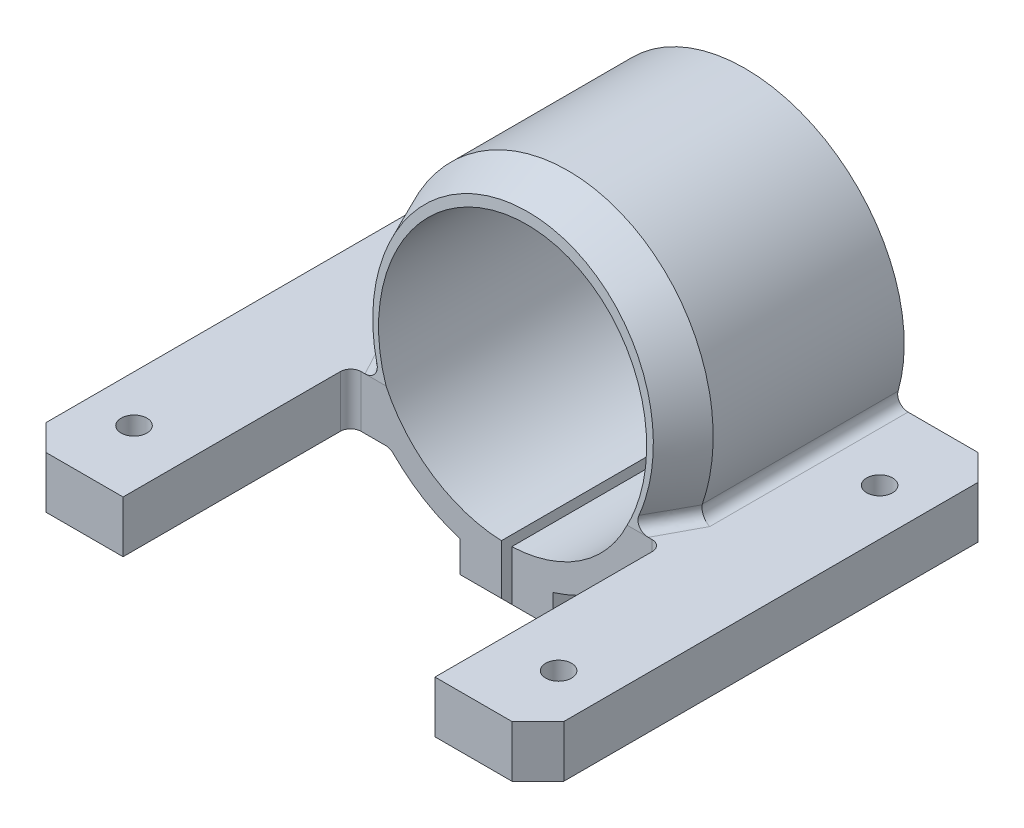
SolidWorks part; units mm, degrees
ref_plane "Plan de face" through (0, 0, 0) normal (0, 0, 1) x (1, 0, 0)
ref_plane "Plan de dessus" through (0, 0, 0) normal (0, 1, 0) x (1, 0, 0)
ref_plane "Plan de droite" through (0, 0, 0) normal (1, 0, 0) x (0, 0, -1)
sketch "Esquisse1" plane through (0, 0, 0) normal (0, 0, 1) x (1, 0, 0)
  line L0 (-22.4625, -21) -> (-50, -21)
  line L1 (-50, -21) -> (-50, -11)
  line L2 (-50, -11) -> (-28.7152, -11)
  line L3 (50, -11) -> (50, -21)
  line L4 (50, -21) -> (22.4625, -21)
  line L5 (50, -11) -> (28.7152, -11)
  circle A0 centre (0, 0) radius 25.75
  arc A1 (-22.4625, -21) -> (22.4625, -21) centre (0, 0) ccw
  arc A2 (-28.7152, -11) -> (28.7152, -11) centre (0, 0) cw
  dimension "D1" = 51.5
  dimension "D2" = 100
  dimension "D4" = 10
  dimension "D5" = 5
  dimension "D3" = 50
  dimension "D6" = 11
extrude "Boss.-Extru.1" add sketch "Esquisse1" along normal blind 90
sketch "Esquisse2" plane through (0, 0, 90) normal (0, 0, 1) x (1, 0, 0)
  line L0 (-9, -24.126) -> (-5.6186, -28.4245)
  line L1 (-5.6186, -28.4245) -> (0, -29.6543)
  line L2 (0, -29.6543) -> (6.455, -28.4245)
  line L3 (6.455, -28.4245) -> (9, -24.126)
  line L4 (9, -24.126) -> (9, -40.395)
  line L5 (9, -40.395) -> (-9, -40.395)
  line L6 (-9, -40.395) -> (-9, -24.126)
  circle A0 centre (0, 0) radius 25.75 construction
  arc A1 (-22.4625, -21) -> (22.4625, -21) centre (0, 0) ccw construction
  point P4 (0, -30.75)
  dimension "D1" = 18
  dimension "D2" = 9
extrude "Boss.-Extru.2" add sketch "Esquisse2" against normal up to surface (90 mm away)
sketch "Esquisse3" plane through (0, 0, 90) normal (0, 0, 1) x (1, 0, 0)
  line L0 (-9, -40.395) -> (9, -40.395) construction
  line L1 (-1, -40.395) -> (1, -40.395)
  line L2 (-1, -40.395) -> (-1, -17.0791)
  line L3 (-1, -17.0791) -> (1, -17.0791)
  line L4 (1, -40.395) -> (1, -17.0791)
  line L5 (-9, -29.4034) -> (-9, -40.395) construction
  line L6 (9, -40.395) -> (9, -29.4034) construction
  dimension "D1" = 8
  dimension "D2" = 8
  dimension "D3" = 2
extrude "Enlèv. mat.-Extru.1" cut sketch "Esquisse3" against normal through all contours L4 L3 L2 L1
sketch "Esquisse4" plane through (9, 0, 0) normal (1, 0, 0) x (0, 0, -1)
  line L0 (-90, -40.395) -> (-90, -29.4034) construction
  line L1 (0, -40.395) -> (-90, -40.395) construction
  circle A0 centre (-35, -35.395) radius 2.5
  circle A1 centre (-10, -35.395) radius 2.5
  dimension "D1" = 55
  dimension "D2" = 25
  dimension "D3" = 5
extrude "Enlèv. mat.-Extru.2" cut sketch "Esquisse4" against normal through all
sketch "Esquisse5" plane through (0, -11, 0) normal (0, 1, 0) x (1, 0, 0)
  line L0 (-50, -90) -> (-50, 0) construction
  line L2 (-28.7152, 0) -> (-50, 0) construction
  circle A0 centre (41, -15) radius 2.5
  circle A1 centre (-41, -15) radius 2.5
  dimension "D1" = 82
  dimension "D2" = 9
  dimension "D4" = 15
extrude "Enlèv. mat.-Extru.3" cut sketch "Esquisse5" against normal through all
sketch "Esquisse8" plane through (0, -21, 0) normal (0, -1, 0) x (1, 0, 0)
  line L1 (-45.2147, 15) -> (-43.1073, 11.35)
  line L2 (-43.1073, 11.35) -> (-38.8927, 11.35)
  line L3 (-38.8927, 11.35) -> (-36.7853, 15)
  line L4 (-36.7853, 15) -> (-38.8927, 18.65)
  line L5 (-38.8927, 18.65) -> (-43.1073, 18.65)
  line L6 (-43.1073, 18.65) -> (-45.2147, 15)
  line L7 (45.2147, 15) -> (43.1073, 18.65)
  line L8 (43.1073, 18.65) -> (38.8927, 18.65)
  line L9 (38.8927, 18.65) -> (36.7853, 15)
  line L10 (36.7853, 15) -> (38.8927, 11.35)
  line L11 (38.8927, 11.35) -> (43.1073, 11.35)
  line L12 (43.1073, 11.35) -> (45.2147, 15)
  circle A0 centre (-41, 15) radius 3.65 construction
  circle A1 centre (41, 15) radius 3.65 construction
  dimension "D1" = 7.3
  dimension "D2" = 7.3
extrude "Enlèv. mat.-Extru.6" cut sketch "Esquisse8" against normal blind 3.5 contours L6 L1 L2 L3 L4 L5
pattern_linear "Répétition linéaire1" count 2 spacing 62 along (0, 0, 1) of "Enlèv. mat.-Extru.3", "Enlèv. mat.-Extru.6"
sketch "Esquisse9" plane through (0, -11, 0) normal (0, 1, 0) x (1, 0, 0)
  line L0 (-28.7152, -90) -> (-50, -90) construction
  line L1 (-30.1117, -90) -> (30.1235, -90)
  line L2 (-30.1117, -90) -> (-30.1117, -46.0412)
  line L3 (-30.1117, -46.0412) -> (30.1235, -46.0412)
  line L4 (30.1235, -90) -> (30.1235, -46.0412)
  line L5 (50, -90) -> (28.7152, -90) construction
extrude "Enlèv. mat.-Extru.7" cut sketch "Esquisse9" against normal through all and the other way through all draft 6
sketch "Esquisse10" plane through (9, 0, 0) normal (1, 0, 0) x (0, 0, -1)
  line L1 (-13.2029, -38.1344) -> (-9.229, -39.5385)
  line L2 (-9.229, -39.5385) -> (-6.0261, -36.799)
  line L3 (-6.0261, -36.799) -> (-6.7971, -32.6555)
  line L4 (-6.7971, -32.6555) -> (-10.771, -31.2514)
  line L5 (-10.771, -31.2514) -> (-13.9739, -33.9909)
  line L6 (-13.9739, -33.9909) -> (-13.2029, -38.1344)
  line L7 (-38.8077, -33.5881) -> (-38.4687, -37.7891)
  line L8 (-38.4687, -37.7891) -> (-34.661, -39.596)
  line L9 (-34.661, -39.596) -> (-31.1923, -37.2018)
  line L10 (-31.1923, -37.2018) -> (-31.5313, -33.0008)
  line L11 (-31.5313, -33.0008) -> (-35.339, -31.194)
  line L12 (-35.339, -31.194) -> (-38.8077, -33.5881)
  circle A0 centre (-10, -35.395) radius 3.65 construction
  circle A1 centre (-35, -35.395) radius 3.65 construction
  dimension "D1" = 7.3
  dimension "D2" = 7.3
extrude "Enlèv. mat.-Extru.8" cut sketch "Esquisse10" against normal blind 4
chamfer "Chanfrein1" distance 5 angle 45 8 edges at (50, -16, 90) (-50, -16, 90) (-50, -16, 0) (50, -16, 0) (-5, -40.395, 46.0412) (5, -40.395, 46.0412) (-5, -40.395, 0) (5, -40.395, 0)
chamfer "Chanfrein2" distance 3 angle 63 1 edges at (0, 30.75, 41.6531)
fillet "Congé1" radius 2 8 edges at (30.1235, -16, 46.0412) (-30.1117, -16, 46.0412) (-22.4625, -21, 23.0206) (22.4625, -21, 23.0206)
